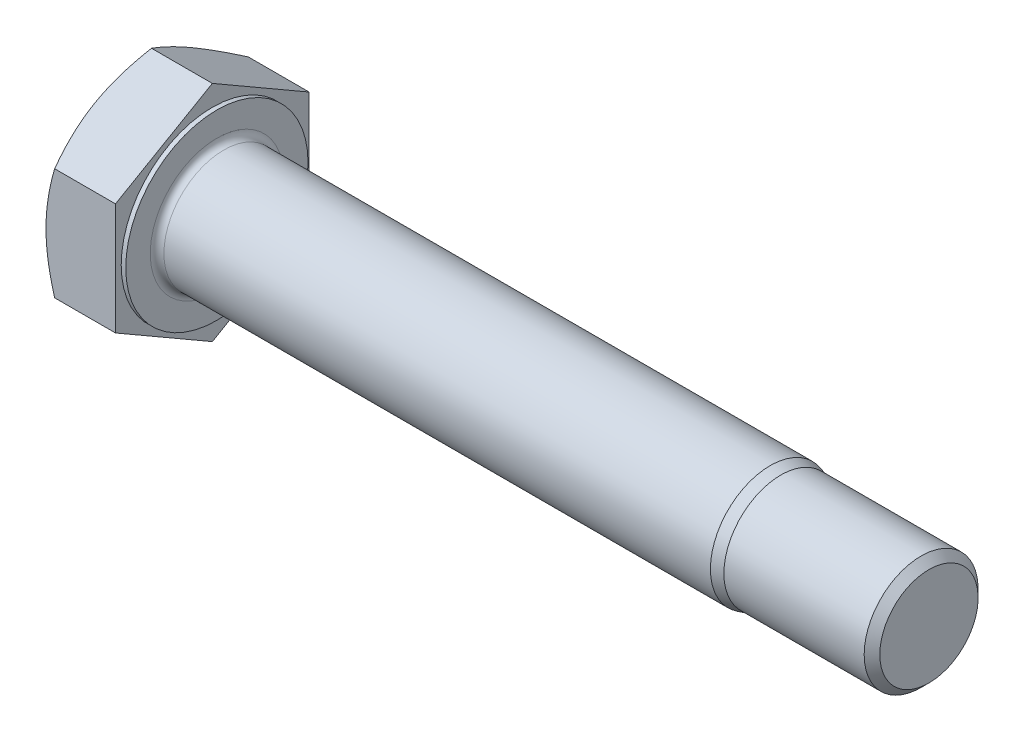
SolidWorks part; units mm, degrees
ref_plane "Plane1" through (0, 0, 0) normal (0, 0, 1) x (1, 0, 0)
ref_plane "Plane2" through (0, 0, 0) normal (0, 1, 0) x (1, 0, 0)
ref_plane "Plane3" through (0, 0, 0) normal (1, 0, 0) x (0, 0, -1)
sketch "HeadSke" plane through (0, 0, 0) normal (1, 0, 0) x (0, 0, -1)
  line L0 (17, 9.815) -> (17, -9.815)
  line L1 (-17, 9.815) -> (-17, -9.815)
  line L2 (17, -9.815) -> (0, -19.6299)
  line L3 (0, -19.6299) -> (-17, -9.815)
  line L4 (17, 9.815) -> (0, 19.6299)
  line L5 (0, 19.6299) -> (-17, 9.815)
  line L6 (0, 19.6299) -> (0, -19.6299) construction
  dimension "Width_flats" = 34
  dimension "D2" = 120
extrude "BaseHead" add sketch "HeadSke" along normal blind 13
sketch "BodySke" plane through (0, 0, 0) normal (0, 0, 1) x (1, 0, 0)
  line L0 (0, 10.5) -> (0, 0)
  line L2 (0, 0) -> (138, 0)
  line L4 (138, 0) -> (138, 8.626)
  line L5 (13, 19.6299) -> (13, 9.815) construction
  line L6 (138, 8.626) -> (136.626, 10)
  line L7 (0, 0) -> (194.2747, 0) construction
  line L8 (138, -8.626) -> (136.626, -10) construction
  line L9 (0, -10) -> (136.626, -10) construction
  line L10 (15.5, 15.24) -> (15.5, -1.27) construction
  line L11 (112, 10) -> (110.134, 10.5)
  line L12 (13, 9.815) -> (13, -9.815) construction
  line L13 (110.134, 10.5) -> (0, 10.5)
  line L15 (112, 10) -> (136.626, 10)
  dimension "D1" = 75
  dimension "Length" = 125
  dimension "Body_ch_ang" = 45
  dimension "Diameter" = 20
  dimension "Minor_dia" = 17.252
  dimension "Advance" = 2.5
  dimension "Thread_nom" = 26
  dimension "Shank_dia" = 21
revolve "BaseBody" add sketch "BodySke" angle 360 about L7
sketch "Sketch3" plane through (0, 0, 0) normal (0, 1, 0) x (1, 0, 0)
  line L0 (4.25, 24.3612) -> (-4.25, 9.6388)
  line L1 (4.25, 24.3612) -> (-2.924, 28.5031)
  line L2 (-4.25, 9.6388) -> (-11.424, 13.7807)
  line L3 (-2.924, 28.5031) -> (-11.424, 13.7807)
  line L4 (0, 17) -> (0, 0) construction
  line L6 (0, 0) -> (99.06, 0) construction
  dimension "Head_ch_ang" = 30
revolve "HeadChamfer" cut sketch "Sketch3" angle 360 about L6
sketch "Sketch4" plane through (0, 0, 0) normal (0, 0, 1) x (1, 0, 0)
  line L0 (13, 19.6299) -> (1.5184, 19.6299) construction
  line L1 (13, 19.6299) -> (13, 9.815) construction
  line L2 (13, 16) -> (12.2, 16)
  line L3 (13, 16) -> (13, 19.6299)
  line L4 (13, 19.6299) -> (12.2, 19.6299)
  line L5 (0, 0) -> (95.25, 0) construction
  line L6 (0, 0) -> (194.2747, 0) construction
  line L7 (12.2, 16) -> (12.2, 19.6299)
  dimension "Bearing_ht" = 0.8
  dimension "Bearing_dia" = 32
revolve "BearingFace" cut sketch "Sketch4" angle 360 about L5
fillet "HeadFillet" radius 1.2 1 edges at (13, 0, -10.5)
sketch "ThdSchSke" plane through (0, 0, 0) normal (0, 0, 1) x (1, 0, 0)
  line L0 (114.5, -8.626) -> (113.5379, -10)
  line L1 (114.5, -8.626) -> (115.4621, -10)
  line L2 (115.4621, -10) -> (115.4621, -12.5)
  line L3 (-3.175, 0) -> (5.1513, 0) construction
  line L5 (115.4621, -12.5) -> (113.5379, -12.5)
  line L6 (113.5379, -12.5) -> (113.5379, -10)
  dimension "Thread_minor" = 17.252
  dimension "Diameter" = 20
  dimension "Start" = 114.5
  dimension "SideAngle" = 55
  dimension "VeeAngle" = 70
  dimension "Overcut" = 25
revolve "ThreadSchematic" [suppressed] cut sketch "ThdSchSke" angle 360 about L3
pattern_linear "ThdSchPat" [suppressed]
equation "\"Thread_minor@ThreadCosmetic\" = \"Minor_dia@BodySke\""
equation "\"Thread_length@ThreadCosmetic\" = \"Thread_nom@BodySke\" - \"Advance@BodySke\""
equation "\"Thread_minor@ThdSchSke\" = \"Minor_dia@BodySke\""
equation "\"Diameter@ThdSchSke\" = \"Diameter@BodySke\""
equation "\"Overcut@ThdSchSke\" = \"Diameter@BodySke\" * 1.25"
equation "\"Start@ThdSchSke\" = \"Head_ht@BaseHead\" + \"Length@BodySke\" - \"Thread_length@ThreadCosmetic\"  '---Non-countersunk---"
equation "\"Num_threads@ThdSchPat\" = int( \"Thread_length@ThreadCosmetic\" / \"Advance@BodySke\" + 0.999 )  + 1"
equation "\"Advance@ThdSchPat\" = \"Thread_length@ThreadCosmetic\" /  (\"Num_threads@ThdSchPat\" - 1) 'relax it"
equation "\"Num_threads@ThdSchPat\" = \"Num_threads@ThdSchPat\" - sgn( \"Num_threads@ThdSchPat\" - 1) '---chamfered tips only---"
